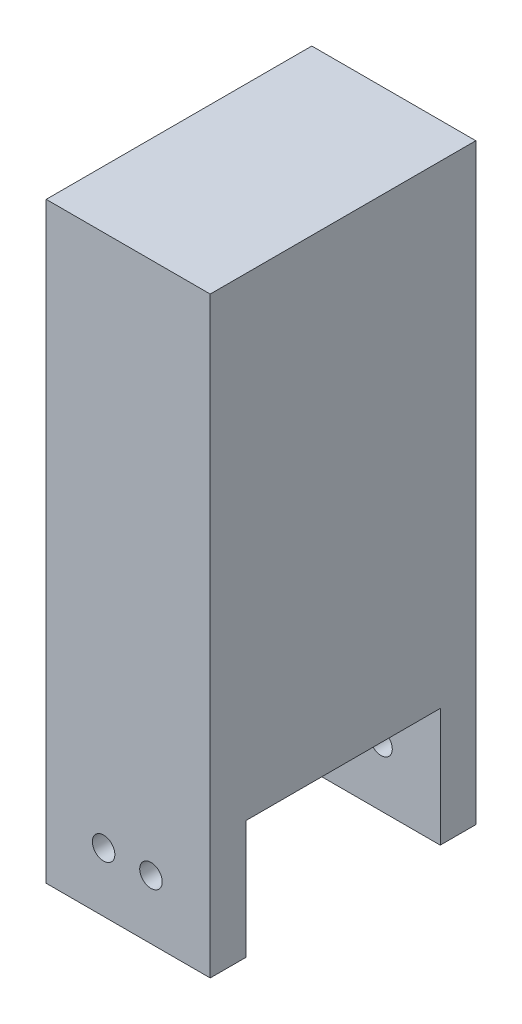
SolidWorks part; units mm, degrees
ref_plane "Front Plane" through (0, 0, 0) normal (0, 0, 1) x (1, 0, 0)
ref_plane "Top Plane" through (0, 0, 0) normal (0, 1, 0) x (1, 0, 0)
ref_plane "Right Plane" through (0, 0, 0) normal (1, 0, 0) x (0, 0, -1)
sketch "Sketch1" plane through (0, 0, 0) normal (0, 0, 1) x (1, 0, 0)
  line L1 (24, 0) -> (10.1543, 0)
  line L2 (24, 0) -> (24, 50)
  line L3 (24, 50) -> (10.1543, 50)
  line L4 (10.1543, 0) -> (10.1543, 50)
  circle A0 centre (19, 5) radius 0.95 construction
  circle A1 centre (19, 5) radius 0.95
  circle A2 centre (15, 5) radius 0.95 construction
  circle A3 centre (15, 5) radius 0.95
  dimension "D1" = 50
  dimension "D2" = 13.8457
extrude "Boss-Extrude1" add sketch "Sketch1" along normal blind 3
ref_plane "Plane1" through (0, 0, -8.21) normal (0, 0, 1) x (1, 0, 0)
mirror "Mirror2" about plane through (0, 0, -8.21) normal (0, 0, 1)
sketch "Sketch2" plane through (0, 0, 0) normal (0, 0, -1) x (-1, 0, 0)
  line L1 (-24, 50) -> (-10.1543, 50)
  line L2 (-24, 50) -> (-24, 10)
  line L3 (-24, 10) -> (-10.1543, 10)
  line L4 (-10.1543, 50) -> (-10.1543, 10)
extrude "Boss-Extrude2" add sketch "Sketch2" along normal up to next
